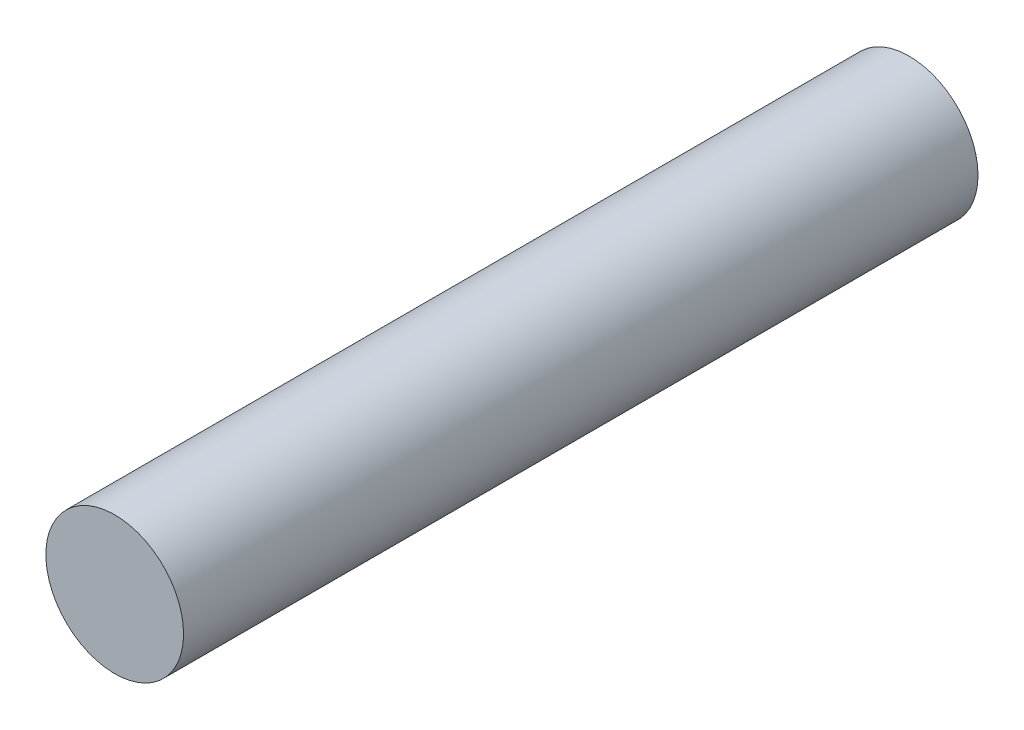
SolidWorks part; units mm, degrees
ref_plane "Face" through (0, 0, 0) normal (0, 0, 1) x (1, 0, 0)
ref_plane "Dessus" through (0, 0, 0) normal (0, 1, 0) x (1, 0, 0)
ref_plane "Droite" through (0, 0, 0) normal (1, 0, 0) x (0, 0, -1)
sketch "Esquisse1" plane through (0, 0, 0) normal (0, 0, 1) x (1, 0, 0)
  circle A0 centre (0, 0) radius 104
  dimension "D1" = 208
extrude "Base-Extrusion" add sketch "Esquisse1" along normal blind 1200
